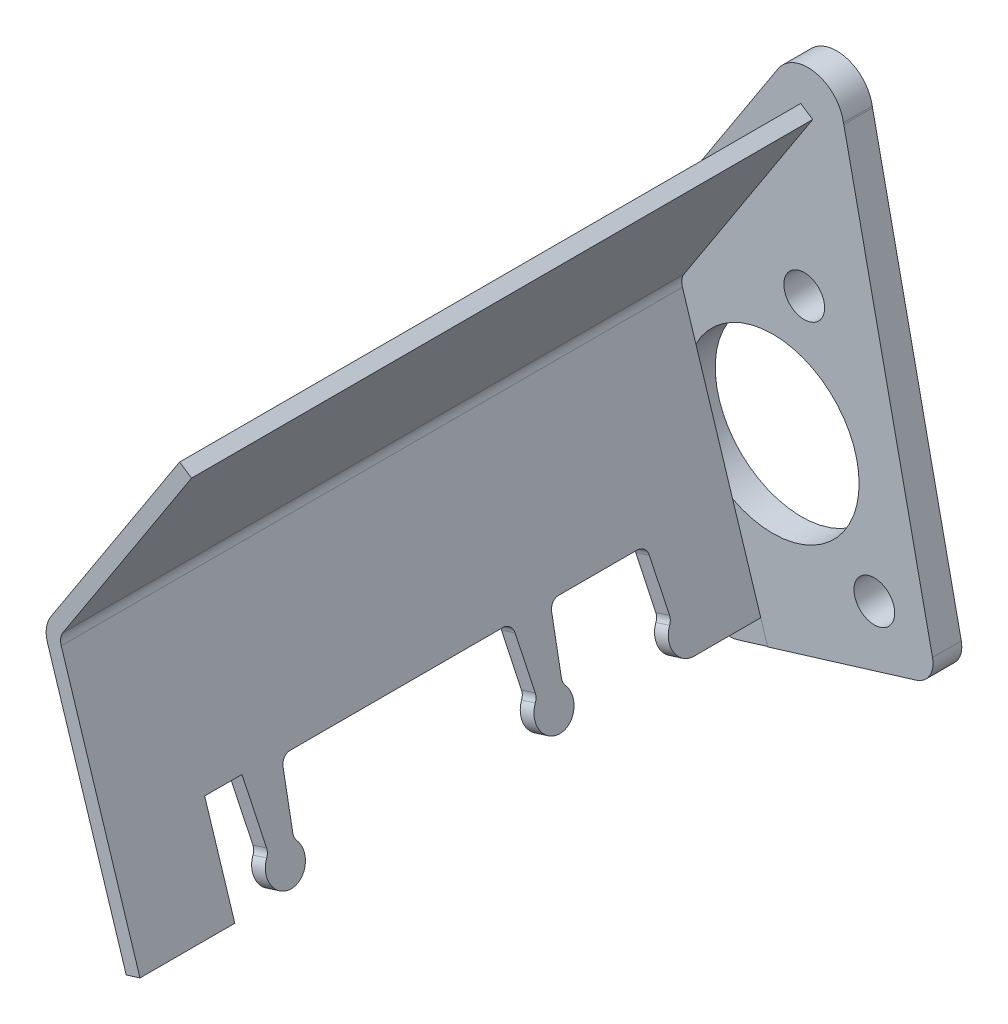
SolidWorks part; units mm, degrees
ref_plane "Plan de face" through (0, 0, 0) normal (0, 0, 1) x (1, 0, 0)
ref_plane "Plan de dessus" through (0, 0, 0) normal (0, 1, 0) x (1, 0, 0)
ref_plane "Plan de droite" through (0, 0, 0) normal (1, 0, 0) x (0, 0, -1)
sketch "Esquisse1" plane through (0, 0, 0) normal (0, 0, 1) x (1, 0, 0)
  line L2 (-6.821, -40.5157) -> (30.563, -29.0862)
  line L3 (-33.4322, -4.7325) -> (-27.5881, 20.5809)
  line L4 (33.9991, -23.2668) -> (15.5066, 63.7337)
  line L5 (1.7512, 66.8669) -> (-26.2311, 23.7778)
  line L6 (-31.6748, -13.0001) -> (-12.276, -38.7432)
  arc A0 (15.4385, 64.0191) -> (1.7512, 66.8669) centre (8.0413, 62.7821) ccw
  arc A1 (15.5066, 63.7337) -> (15.4385, 64.0191) centre (9.6377, 62.4862) ccw
  arc A2 (-33.4322, -4.7325) -> (-31.6748, -13.0001) centre (-23.6885, -6.982) ccw
  arc A4 (30.563, -29.0862) -> (33.9991, -23.2668) centre (29.1076, -24.3027) ccw
  circle A5 centre (-23.6885, -6.982) radius 4.25
  circle A6 centre (7.2544, 28.6205) radius 4.25
  circle A7 centre (21.873, -19.1947) radius 4.25
  arc A8 (-26.2311, 23.7778) -> (-27.5881, 20.5809) centre (-17.8444, 18.3314) ccw
  arc A9 (-12.276, -38.7432) -> (-6.821, -40.5157) centre (-8.2829, -35.7341) ccw
  dimension "D2" = 15
  dimension "D3" = 10
  dimension "D1" = 110
extrude "Extrusion2" add sketch "Esquisse1" along normal blind 6
sketch "Esquisse3" plane through (0, 0, 6) normal (0, 0, 1) x (1, 0, 0)
  line L0 (6.5207, 63.0238) -> (-20.2718, 21.767)
  line L1 (9.0368, 61.3899) -> (-17.8005, 20.0642)
  line L2 (-21.0431, 16.7404) -> (-4.5982, -35.1305)
  line L3 (-18.1442, 17.5236) -> (-1.7291, -34.2533)
  line L4 (6.5207, 63.0238) -> (9.0368, 61.3899)
  line L5 (-4.5982, -35.1305) -> (-1.7291, -34.2533)
  line L7 (-6.821, -40.5157) -> (30.563, -29.0862) construction
  arc A0 (-17.8005, 20.0642) -> (-18.1442, 17.5236) centre (-15.2845, 18.4302) ccw
  arc A2 (-20.2718, 21.767) -> (-21.0431, 16.7404) centre (-15.2857, 18.4294) ccw
  dimension "D5" = 6
  dimension "D6" = 3
  dimension "D2" = 4.5
  dimension "D4" = 12
extrude "Extrusion3" add sketch "Esquisse3" along normal blind 129.5
sketch "Esquisse4" plane through (-11.4389, -3.6265, 0) normal (0.9532, 0.3022, 0) x (0, 0, -1)
  line L0 (-5.8971, -31.8595) -> (-19.8971, -31.8595)
  line L1 (-22.6269, -23.9447) -> (-23.7089, -13.6505)
  line L2 (-45.1673, -23.9447) -> (-44.0854, -13.6505)
  line L3 (-53.6979, -11.8595) -> (-98.0963, -11.8595)
  line L4 (-106.6269, -23.9447) -> (-107.9534, -11.3245)
  line L5 (-25.6979, -11.8595) -> (-42.0963, -11.8595)
  line L6 (-50.6269, -23.9447) -> (-51.7089, -13.6505)
  line L7 (-101.1673, -23.9447) -> (-100.0854, -13.6505)
  line L11 (-107.9534, -11.3245) -> (-115.7282, -11.3245)
  line L12 (-115.7282, -11.3245) -> (-115.7282, -51.425)
  line L13 (-115.7282, -51.425) -> (-5.8971, -51.425)
  line L14 (-5.8971, -51.425) -> (-5.8971, -31.8595)
  arc A0 (-23.043, -25.389) -> (-19.8971, -31.8595) centre (-19.8971, -27.8595) ccw
  arc A1 (-23.043, -25.389) -> (-22.6269, -23.9447) centre (-24.616, -24.1538) ccw
  arc A2 (-23.7089, -13.6505) -> (-25.6979, -11.8595) centre (-25.6979, -13.8595) ccw
  arc A3 (-42.0963, -11.8595) -> (-44.0854, -13.6505) centre (-42.0963, -13.8595) ccw
  arc A4 (-51.043, -25.389) -> (-44.7512, -25.389) centre (-47.8971, -27.8595) ccw
  arc A5 (-45.1673, -23.9447) -> (-44.7512, -25.389) centre (-43.1783, -24.1538) ccw
  arc A6 (-51.043, -25.389) -> (-50.6269, -23.9447) centre (-52.616, -24.1538) ccw
  arc A7 (-51.7089, -13.6505) -> (-53.6979, -11.8595) centre (-53.6979, -13.8595) ccw
  arc A8 (-107.043, -25.389) -> (-100.7512, -25.389) centre (-103.8971, -27.8595) ccw
  arc A9 (-101.1673, -23.9447) -> (-100.7512, -25.389) centre (-99.1783, -24.1538) ccw
  arc A10 (-98.0963, -11.8595) -> (-100.0854, -13.6505) centre (-98.0963, -13.8595) ccw
  arc A11 (-107.043, -25.389) -> (-106.6269, -23.9447) centre (-108.616, -24.1538) ccw
extrude "Enlèv. mat.-Extru.1" cut sketch "Esquisse4" against normal through all
sketch "Esquisse7" plane through (0, 0, 6) normal (0, 0, 1) x (1, 0, 0)
  circle A2 centre (0.6973, 0.4735) radius 18
  dimension "D1" = 36
extrude "Enlèv. mat.-Extru.2" cut sketch "Esquisse7" against normal through all
